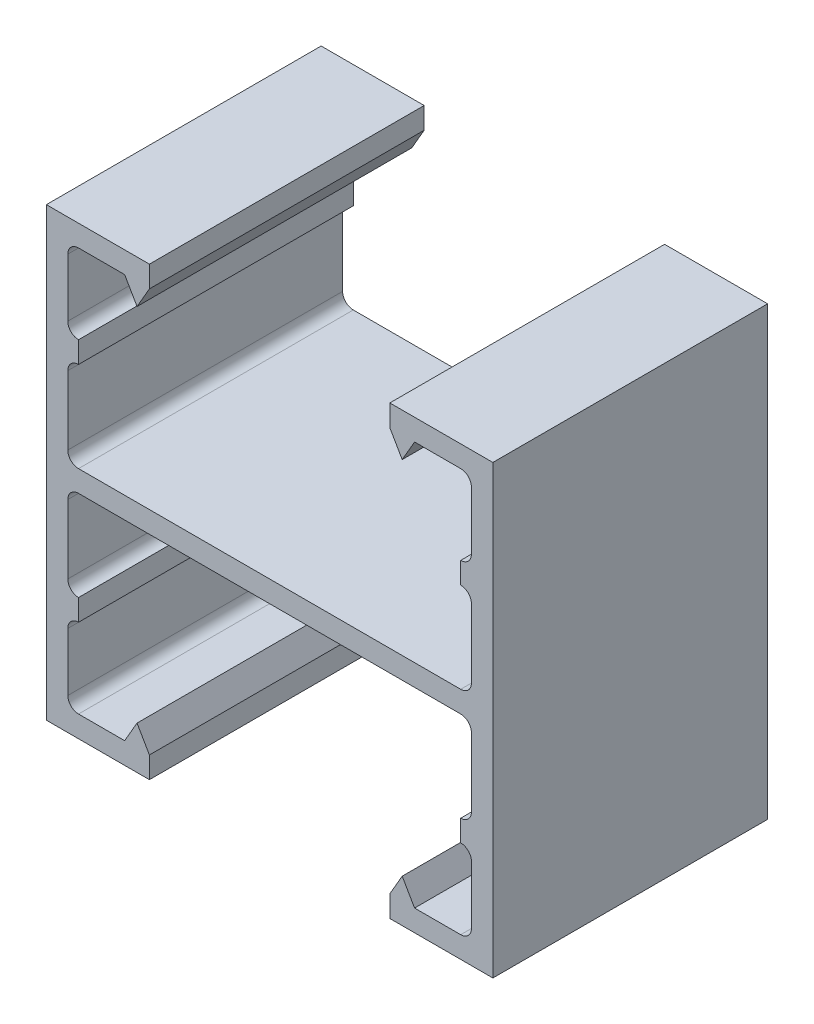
SolidWorks part; units mm, degrees
ref_plane "Plane1" through (0, 0, 0) normal (0, 0, 1) x (1, 0, 0)
ref_plane "Plane2" through (0, 0, 0) normal (0, 1, 0) x (1, 0, 0)
ref_plane "Plane3" through (0, 0, 0) normal (1, 0, 0) x (0, 0, -1)
sketch "Sketch1" plane through (0, 0, 0) normal (0, 0, 1) x (1, 0, 0)
  line L0 (-11.1125, 20.6375) -> (-20.6375, 20.6375)
  line L1 (-20.6375, 20.6375) -> (-20.6375, -20.6375)
  line L2 (-13.4002, -18.6563) -> (-17.6657, -18.6563)
  line L3 (20.6375, -20.6375) -> (20.6375, 20.6375)
  line L4 (20.6375, 20.6375) -> (11.1125, 20.6375)
  line L5 (17.6657, 18.6563) -> (13.4002, 18.6563)
  line L6 (18.6563, 1.9812) -> (18.6563, 9.3282)
  line L7 (-17.6657, 0.9906) -> (17.6657, 0.9906)
  line L8 (-18.6563, 17.6657) -> (-18.6563, 11.3093)
  line L9 (-13.4002, 18.6563) -> (-17.6657, 18.6563)
  line L10 (13.4002, 18.6563) -> (12.2563, 16.6751)
  line L11 (12.2563, 16.6751) -> (11.1125, 18.6563)
  line L12 (11.1125, 18.6563) -> (11.1125, 20.6375)
  line L13 (-13.4002, 18.6563) -> (-12.2563, 16.6751)
  line L14 (-12.2563, 16.6751) -> (-11.1125, 18.6563)
  line L15 (-11.1125, 18.6563) -> (-11.1125, 20.6375)
  line L16 (22.86, 0) -> (-25.4, 0) construction
  line L17 (12.2563, -16.6751) -> (11.1125, -18.6563)
  line L18 (13.4002, -18.6563) -> (12.2563, -16.6751)
  line L19 (17.6657, -18.6563) -> (13.4002, -18.6563)
  line L20 (20.6375, -20.6375) -> (11.1125, -20.6375)
  line L21 (11.1125, -18.6563) -> (11.1125, -20.6375)
  line L22 (-11.1125, -20.6375) -> (-20.6375, -20.6375)
  line L23 (-11.1125, -18.6563) -> (-11.1125, -20.6375)
  line L24 (-12.2563, -16.6751) -> (-11.1125, -18.6563)
  line L25 (-13.4002, -18.6563) -> (-12.2563, -16.6751)
  line L26 (-18.6563, -17.6657) -> (-18.6563, -11.3094)
  line L27 (18.6563, -1.9812) -> (18.6563, -9.3281)
  line L28 (-17.6657, -0.9906) -> (17.6657, -0.9906)
  line L29 (-18.6563, 11.3093) -> (-17.6657, 11.3093)
  line L30 (-17.6657, 11.3093) -> (-17.6657, 9.3281)
  line L31 (-17.6657, 9.3281) -> (-18.6563, 9.3281)
  line L32 (-18.6563, 9.3281) -> (-18.6563, 1.9812)
  line L33 (18.6563, 11.3093) -> (17.6657, 11.3094)
  line L34 (17.6657, 11.3094) -> (17.6657, 9.3282)
  line L35 (17.6657, 9.3282) -> (18.6563, 9.3282)
  line L36 (18.6563, 11.3093) -> (18.6563, 17.6657)
  line L37 (17.6657, -9.3281) -> (18.6563, -9.3281)
  line L38 (17.6657, -11.3093) -> (17.6657, -9.3281)
  line L39 (18.6563, -11.3093) -> (17.6657, -11.3093)
  line L40 (-17.6657, -9.3281) -> (-18.6563, -9.3281)
  line L41 (-17.6657, -11.3093) -> (-17.6657, -9.3281)
  line L42 (-18.6563, -11.3094) -> (-17.6657, -11.3093)
  line L43 (18.6563, -11.3093) -> (18.6563, -17.6657)
  line L44 (-18.6563, -9.3281) -> (-18.6563, -1.9812)
  arc A0 (-18.6563, 1.9812) -> (-17.6657, 0.9906) centre (-17.6657, 1.9812) ccw
  arc A1 (-17.6657, 18.6563) -> (-18.6563, 17.6657) centre (-17.6657, 17.6657) ccw
  arc A2 (18.6563, 17.6657) -> (17.6657, 18.6563) centre (17.6657, 17.6657) ccw
  arc A3 (17.6657, 0.9906) -> (18.6563, 1.9812) centre (17.6657, 1.9812) ccw
  arc A4 (18.6563, -17.6657) -> (17.6657, -18.6563) centre (17.6657, -17.6657) cw
  arc A5 (-17.6657, -18.6563) -> (-18.6563, -17.6657) centre (-17.6657, -17.6657) cw
  arc A6 (17.6657, -0.9906) -> (18.6563, -1.9812) centre (17.6657, -1.9812) cw
  arc A7 (-18.6563, -1.9812) -> (-17.6657, -0.9906) centre (-17.6657, -1.9812) cw
  dimension "D5" = 0.9906
  dimension "D3" = 20.6375
  dimension "D4" = 60
  dimension "D6" = 11.3093
  dimension "Width" = 41.275
  dimension "Height" = 41.275
  dimension "D8" = 20.6375
  dimension "D10" = 22.225
  dimension "edge" = 9.525
  dimension "D13" = 1.1438
  dimension "D1" = 0.9906
extrude "Base-Extrude" add sketch "Sketch1" along normal mid plane 25.4
fillet "Fillet1" radius 0.9906 8 edges at (18.6563, 11.3093, 0) (18.6563, -9.3281, 0) (-18.6563, 11.3093, 0) (-18.6563, -9.3281, 0) (-18.6563, 9.3281, 0) (-18.6563, -11.3094, 0) (18.6563, 9.3282, 0) (18.6563, -11.3093, 0)
equation "\"D8@Sketch1\" = \"Width@Sketch1\" / 2"
equation "\"D10@Sketch1\" = \"Width@Sketch1\" - 2 * \"edge@Sketch1\""
equation "\"D5@Sketch1\" = \"gauge@Sketch1\" / 2"
equation "\"D3@Sketch1\" = \"Height@Sketch1\" / 2"
equation "\"D1@Sketch1\" = \"D5@Sketch1\""
equation "\"D6@Sketch1\" = \"D3@Sketch1\" / 2 + \"D5@Sketch1\""
equation "\"D1@Fillet1\" = \"D5@Sketch1\""
equation "\"D13@Sketch1\" = \"gauge@Sketch1\" * .577350269"
